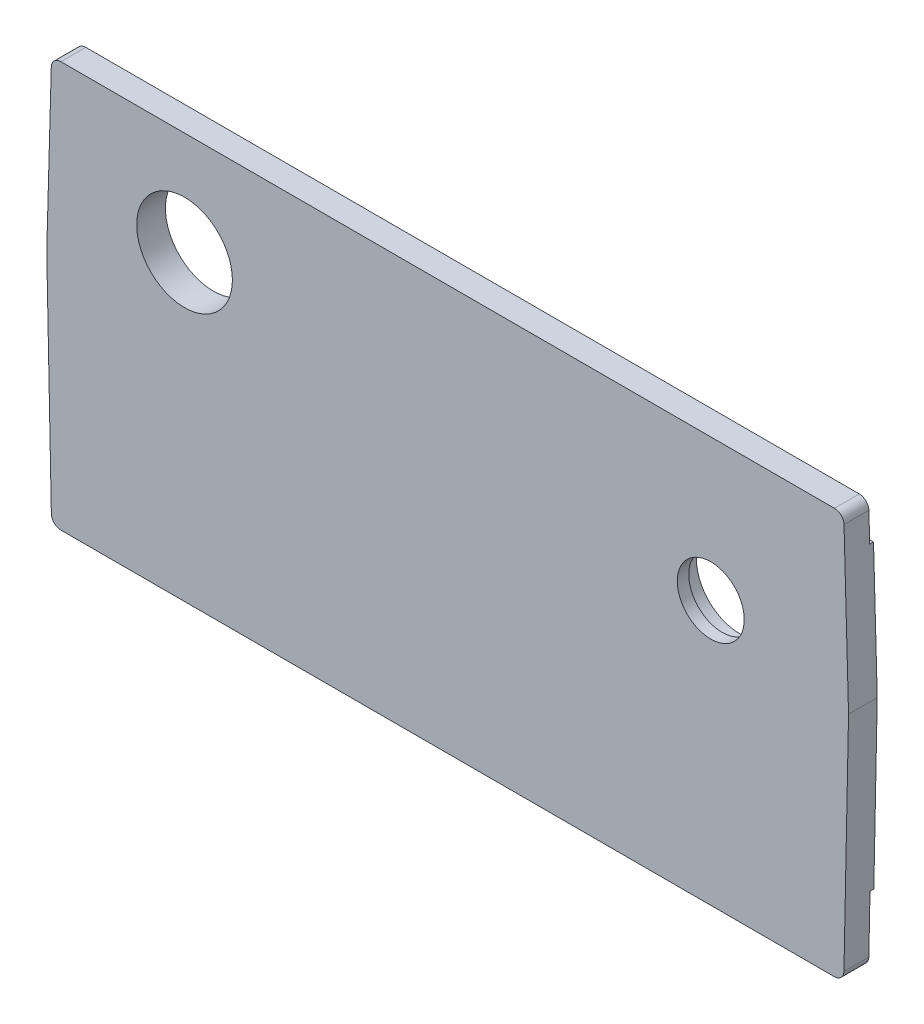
SolidWorks part; units mm, degrees
ref_plane "Plan de face" through (0, 0, 0) normal (0, 0, 1) x (1, 0, 0)
ref_plane "Plan de dessus" through (0, 0, 0) normal (0, 1, 0) x (1, 0, 0)
ref_plane "Plan de droite" through (0, 0, 0) normal (1, 0, 0) x (0, 0, -1)
sketch "Esquisse1" plane through (0, 0, 0) normal (0, 0, 1) x (1, 0, 0)
  line L0 (0, -14.2402) -> (0, 52.3672) construction
  line L1 (-7.052, 0) -> (132.3643, 0) construction
  line L2 (24.168, 31.6) -> (-7.052, 31.6) construction
  line L3 (1.4798, 0) -> (82.3202, 0)
  line L4 (0.4728, 41.4279) -> (0, 24.5)
  line L5 (1.4725, 42.4) -> (82.3275, 42.4)
  line L6 (0, 24.5) -> (0.48, 0.9796)
  line L7 (14.4, 52.3672) -> (14.4, 19.2584) construction
  line L8 (69.4, 52.3672) -> (69.4, 19.2584) construction
  line L9 (83.8, -14.2402) -> (83.8, 52.3672) construction
  line L10 (132.3643, 42.4) -> (-7.052, 42.4) construction
  line L11 (97.7699, 27.6) -> (63.0095, 27.6) construction
  line L12 (41.9, -5.6749) -> (41.9, 11.7857) construction
  line L13 (-1.7114, 24.5) -> (19.692, 24.5) construction
  line L14 (0.5, 48.0749) -> (0.5, -4.6289) construction
  line L15 (83.8, 24.5) -> (83.32, 0.9796)
  line L16 (83.3272, 41.4279) -> (83.8, 24.5)
  circle A0 centre (14.4, 31.6) radius 5
  circle A1 centre (69.4, 27.6) radius 3.5
  arc A2 (0.48, 0.9796) -> (1.4798, 0) centre (1.4798, 1) ccw
  arc A3 (0.4728, 41.4279) -> (1.4725, 42.4) centre (1.4725, 41.4) cw
  arc A4 (83.32, 0.9796) -> (82.3202, 0) centre (82.3202, 1) cw
  arc A5 (83.3272, 41.4279) -> (82.3275, 42.4) centre (82.3275, 41.4) ccw
  dimension "D4" = 14.4
  dimension "D6" = 27.6
  dimension "D7" = 24.5
  dimension "D10" = 1
  dimension "D1" = 14.4
  dimension "D2" = 83.8
  dimension "D3" = 31.6
  dimension "D5" = 42.4
  dimension "D8" = 0.5
  dimension "D9" = 41.9
extrude "Boss.-Extru.1" add sketch "Esquisse1" along normal blind 3
sketch "Esquisse2" plane through (0, 0, 0) normal (0, 0, -1) x (-1, 0, 0)
  circle A0 centre (-69.4, 27.6) radius 4.5
extrude "Enlèv. mat.-Extru.1" cut sketch "Esquisse2" against normal blind 1.8
sketch "Esquisse3" plane through (0, 0, 0) normal (0, 0, -1) x (-1, 0, 0)
  line L0 (4.5515, 0) -> (-90.288, 0) construction
  line L1 (4.5515, 42.4) -> (-90.288, 42.4) construction
  line L2 (-90.288, 38.4) -> (4.5515, 38.4) construction
  line L3 (4.5515, 7) -> (-90.288, 7) construction
  line L5 (-85.1999, 42.4) -> (0.9648, 42.4)
  line L6 (-85.1999, 42.4) -> (-85.1999, 38.4)
  line L7 (-85.1999, 38.4) -> (0.9648, 38.4)
  line L8 (0.9648, 42.4) -> (0.9648, 38.4)
  line L9 (-85.1999, 7) -> (0.9648, 7)
  line L10 (-85.1999, 7) -> (-85.1999, 0)
  line L11 (-85.1999, 0) -> (0.9648, 0)
  line L12 (0.9648, 7) -> (0.9648, 0)
  dimension "D1" = 4
  dimension "D2" = 7
extrude "Enlèv. mat.-Extru.2" cut sketch "Esquisse3" against normal blind 0.4
